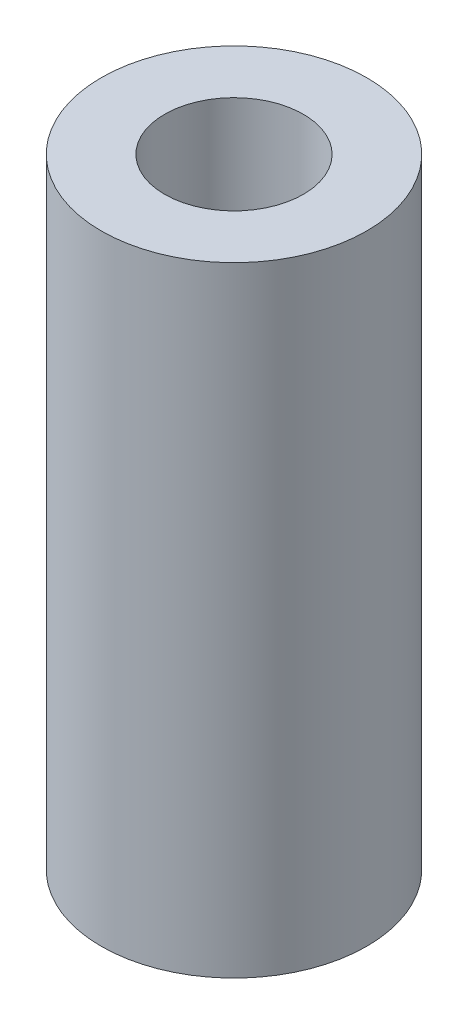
SolidWorks part; units mm, degrees
ref_plane "Front" through (0, 0, 0) normal (0, 0, 1) x (1, 0, 0)
ref_plane "Top" through (0, 0, 0) normal (0, 1, 0) x (1, 0, 0)
ref_plane "Right" through (0, 0, 0) normal (1, 0, 0) x (0, 0, -1)
sketch "Sketch1" plane through (0, 0, 0) normal (0, 1, 0) x (1, 0, 0)
  circle A0 centre (0, 0) radius 2.4892
  circle A1 centre (0, 0) radius 4.7625
  dimension "D1" = 4.9784
  dimension "D2" = 9.525
extrude "Boss-Extrude1" add sketch "Sketch1" along normal blind 22.225
